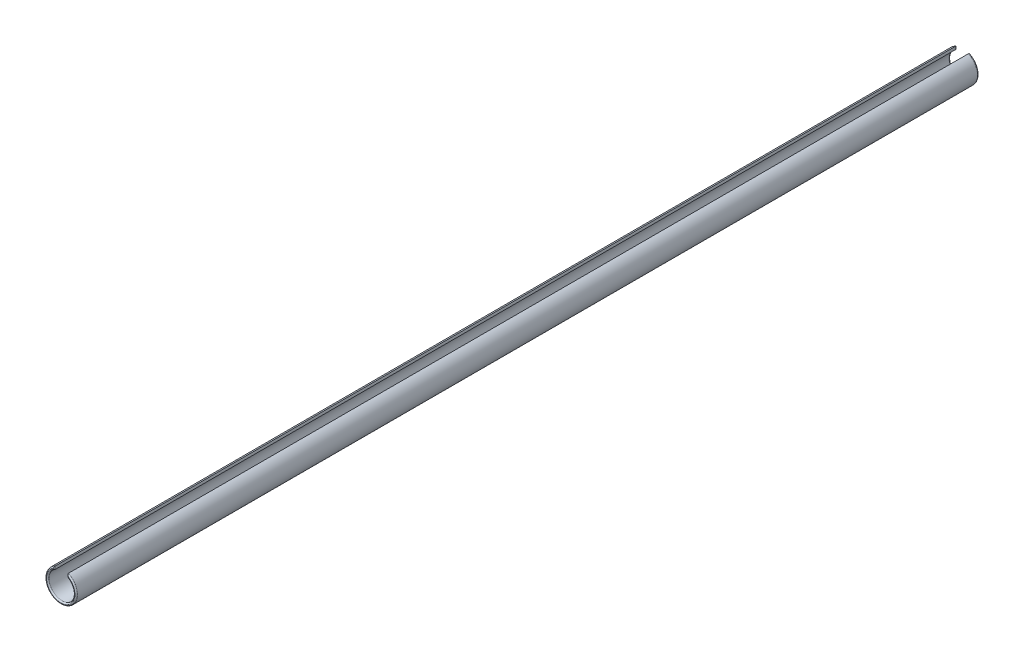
SolidWorks part; units mm, degrees
ref_plane "Plan de face" through (0, 0, 0) normal (0, 0, 1) x (1, 0, 0)
ref_plane "Plan de dessus" through (0, 0, 0) normal (0, 1, 0) x (1, 0, 0)
ref_plane "Plan de droite" through (0, 0, 0) normal (1, 0, 0) x (0, 0, -1)
sketch "Esquisse1" plane through (0, 0, 0) normal (0, 0, 1) x (1, 0, 0)
  circle A0 centre (0, 0) radius 0.6
  dimension "D1" = 1.2
extrude "Extrusion1" add sketch "Esquisse1" along normal blind 35
sketch "Esquisse2" plane through (0, 0, 35) normal (0, 0, 1) x (1, 0, 0)
  circle A0 centre (0, 0) radius 0.5
  dimension "D1" = 1
extrude "Enlèv. mat.-Extru.1" cut sketch "Esquisse2" against normal through all
ref_plane "Plan1" through (0, 1.2, 0) normal (0, 1, 0) x (-1, 0, 0)
sketch "Esquisse3" plane through (0, 1.2, 0) normal (0, 1, 0) x (-1, 0, 0)
  line L1 (-0.25, 35.6131) -> (0.25, 35.6131)
  line L2 (-0.25, 35.6131) -> (-0.25, -1.0948)
  line L3 (-0.25, -1.0948) -> (0.25, -1.0948)
  line L4 (0.25, 35.6131) -> (0.25, -1.0948)
  dimension "D1" = 0.25
  dimension "D2" = 0.5
extrude "Enlèv. mat.-Extru.2" cut sketch "Esquisse3" against normal up to next
fillet "Congé2" radius 0.05 8 edges at (0, -0.5, 35) (0.25, 0.4892, 35) (0, -0.6, 35) (-0.25, 0.4892, 35) (0.25, 0.4892, 0) (0, -0.5, 0) (-0.25, 0.4892, 0) (0, -0.6, 0)
